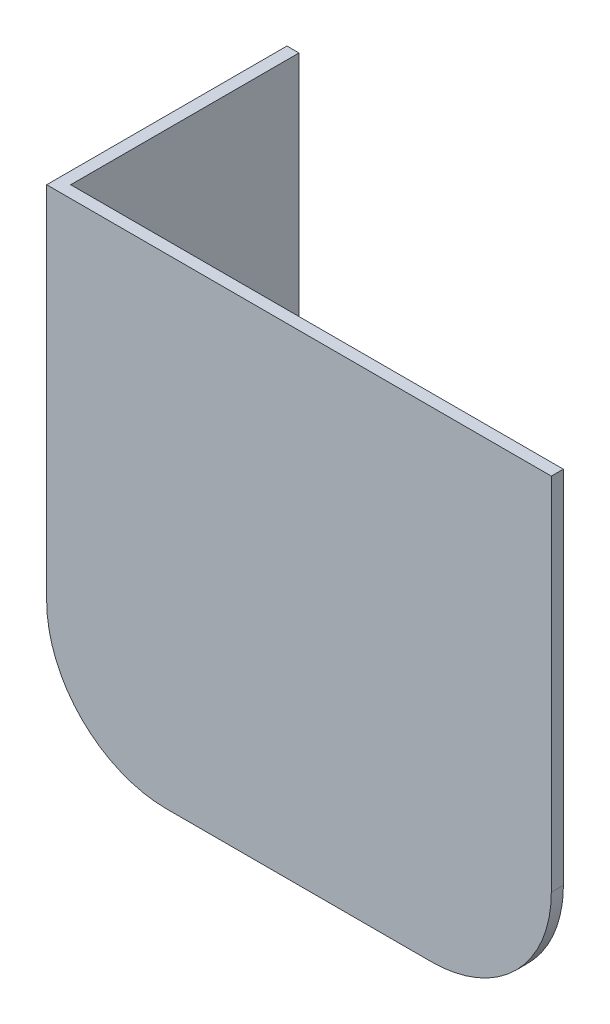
SolidWorks part; units mm, degrees
ref_plane "Front Plane" through (0, 0, 0) normal (0, 0, 1) x (1, 0, 0)
ref_plane "Top Plane" through (0, 0, 0) normal (0, 1, 0) x (1, 0, 0)
ref_plane "Right Plane" through (0, 0, 0) normal (1, 0, 0) x (0, 0, -1)
sketch "Sketch1" plane through (0, 0, 0) normal (0, 1, 0) x (1, 0, 0)
  line L0 (0, 0) -> (0, 254)
  line L1 (0, 0) -> (533.4, 0)
  line L2 (0, 254) -> (12.7, 254)
  line L3 (12.7, 254) -> (12.7, 12.7)
  line L4 (12.7, 12.7) -> (533.4, 12.7)
  line L5 (533.4, 12.7) -> (533.4, 0)
  dimension "D1" = 254
  dimension "D2" = 533.4
  dimension "D3" = 12.7
  dimension "D4" = 12.7
extrude "Extrude1" add sketch "Sketch1" against normal blind 508
sketch "Sketch2" plane through (0, 0, 0) normal (-1, 0, 0) x (0, 0, 1)
  line L0 (-254, -508) -> (-254, 0) construction
  line L1 (-12.6959, -525.78) -> (-254, -525.78)
  line L2 (-12.6959, -525.78) -> (-12.6959, -398.78)
  line L3 (-12.6959, -398.78) -> (-254, -398.78)
  line L4 (-254, -525.78) -> (-254, -398.78)
  dimension "D1" = 127
extrude "Extrude2" cut sketch "Sketch2" against normal through all
fillet "Fillet1" radius 127 1 edges at (0, -508, -6.348)
fillet "Fillet2" radius 127 1 edges at (533.4, -508, -6.348)
